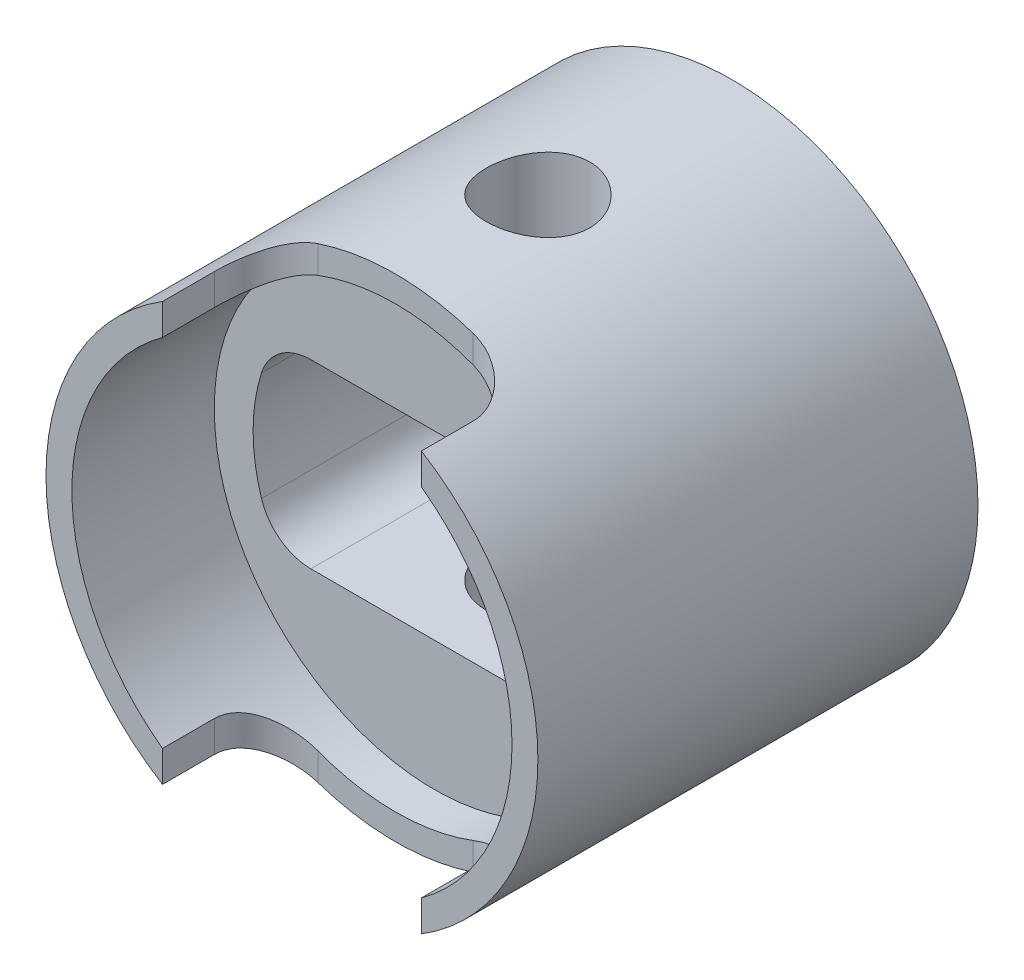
SolidWorks part; units mm, degrees
ref_plane "Face" through (0, 0, 0) normal (0, 0, 1) x (1, 0, 0)
ref_plane "Dessus" through (0, 0, 0) normal (0, 1, 0) x (1, 0, 0)
ref_plane "Droite" through (0, 0, 0) normal (1, 0, 0) x (0, 0, -1)
sketch "Esquisse1" plane through (0, 0, 0) normal (0, 0, 1) x (1, 0, 0)
  circle A0 centre (0, 0) radius 9.5
  dimension "D1" = 19
extrude "Base-Extrusion" add sketch "Esquisse1" along normal blind 17
sketch "Esquisse2" plane through (0, 0, 17) normal (0, 0, 1) x (1, 0, 0)
  circle A2 centre (0, 0) radius 8.5
  circle A3 centre (0, 0) radius 8.5
  dimension "D1" = 1
extrude "Enlèv. mat.-Extru.1" cut sketch "Esquisse2" against normal blind 5.5
sketch "Esquisse3" plane through (0, 0, 0) normal (0, 1, 0) x (1, 0, 0)
  line L0 (0, -17) -> (0, 0) construction
  line L1 (-9.5, -17) -> (9.5, -17) construction
  line L2 (-5, -17) -> (5, -17)
  line L3 (-5, -17) -> (-5, -15)
  line L4 (-3, -13) -> (3, -13)
  line L5 (5, -17) -> (5, -15)
  circle A0 centre (0, -7.5) radius 2
  arc A1 (3, -13) -> (5, -15) centre (3, -15) cw
  arc A2 (-5, -15) -> (-3, -13) centre (-3, -15) cw
  dimension "D1" = 4
  dimension "D6" = 2
  dimension "D7" = 2
  dimension "D2" = 7.5
  dimension "D3" = 10
  dimension "D4" = 4
  dimension "D5" = 5
extrude "Enlèv. mat.-Extru.2" cut sketch "Esquisse3" against normal mid plane 30
sketch "Esquisse4" plane through (0, 0, 11.5) normal (0, 0, 1) x (1, 0, 0)
  line L1 (-4.7697, 3.5) -> (4.7697, 3.5)
  line L3 (-4.7697, -3.5) -> (4.7697, -3.5)
  arc A0 (-6.6776, 2.1) -> (-6.6776, -2.1) centre (0, 0) ccw
  arc A1 (6.6776, -2.1) -> (6.6776, 2.1) centre (0, 0) ccw
  arc A2 (6.6776, -2.1) -> (4.7697, -3.5) centre (4.7697, -1.5) cw
  arc A3 (4.7697, 3.5) -> (6.6776, 2.1) centre (4.7697, 1.5) cw
  arc A4 (-6.6776, -2.1) -> (-4.7697, -3.5) centre (-4.7697, -1.5) ccw
  arc A5 (-6.6776, 2.1) -> (-4.7697, 3.5) centre (-4.7697, 1.5) cw
  dimension "D1" = 14
  dimension "D4" = 2
  dimension "D5" = 2
  dimension "D6" = 2
  dimension "D7" = 2
  dimension "D2" = 7
  dimension "D3" = 3.5
extrude "Enlèv. mat.-Extru.3" cut sketch "Esquisse4" against normal blind 10
fillet "Congé1" radius 1 8 edges at (0, 3.5, 1.5) (0, -3.5, 1.5) (-5.9529, 3.1125, 1.5) (5.9529, 3.1125, 1.5) (7, 0, 1.5) (5.9529, -3.1125, 1.5) (-5.9529, -3.1125, 1.5) (-7, 0, 1.5)
